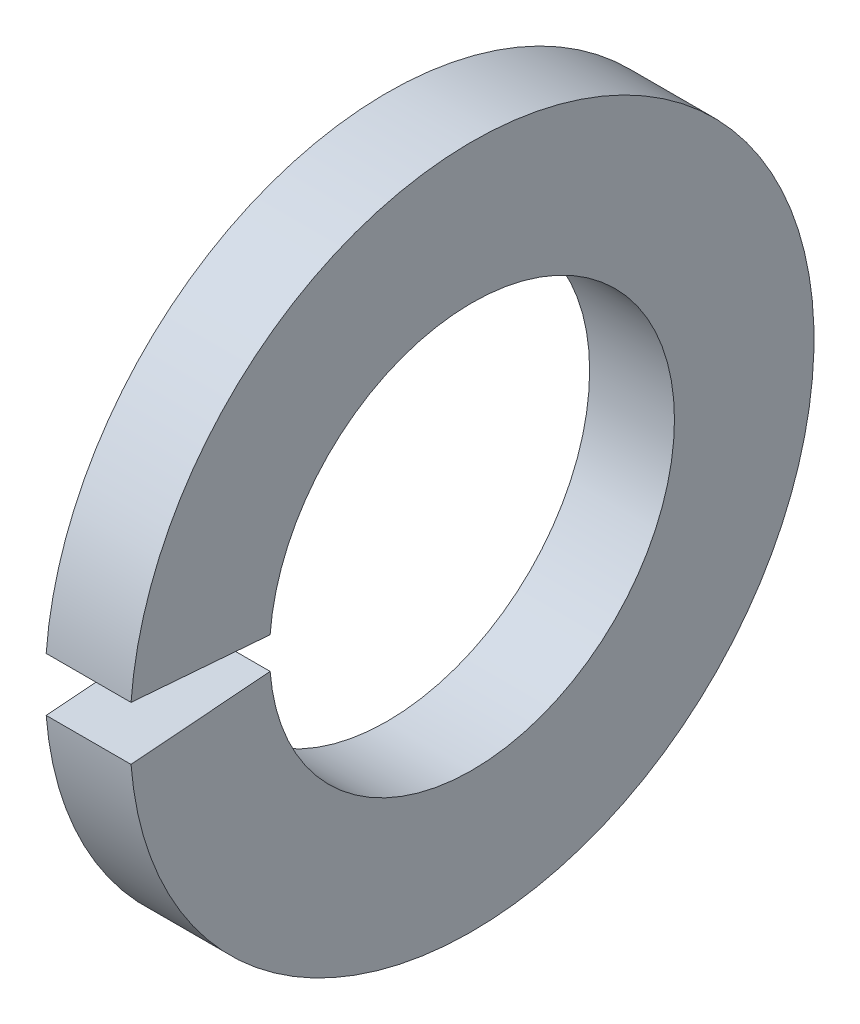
SolidWorks part; units mm, degrees
ref_plane "Plane1" through (0, 0, 0) normal (0, 0, 1) x (1, 0, 0)
ref_plane "Plane2" through (0, 0, 0) normal (0, 1, 0) x (1, 0, 0)
ref_plane "Plane3" through (0, 0, 0) normal (1, 0, 0) x (0, 0, -1)
sketch "Sketch1" plane through (0, 0, 0) normal (0, 0, 1) x (1, 0, 0)
  line L0 (-34.925, 0) -> (9.525, 0) construction
  line L1 (0, 1.8796) -> (0, 3.175)
  line L2 (0, 3.175) -> (-0.7874, 3.175)
  line L3 (-0.7874, 3.175) -> (-0.7874, 1.8796)
  line L4 (-0.7874, 1.8796) -> (0, 1.8796)
revolve "Base-Revolve" add sketch "Sketch1" angle 360 about L0
sketch "Sketch2" plane through (0, 0, 0) normal (-1, 0, 0) x (0, -1, 0)
  line L0 (0, 0) -> (0.2541, 3.2285)
  line L1 (0, -3.175) -> (0, 12.7) construction
  line L2 (0, 0) -> (-0.2541, 3.2285)
  arc A0 (0.2541, 3.2285) -> (-0.2541, 3.2285) centre (0, 0) ccw
extrude "Gap" cut sketch "Sketch2" along normal through all
equation "\"D1@Sketch2\" = \"Outside_dia@Sketch1\" * 0.51"
